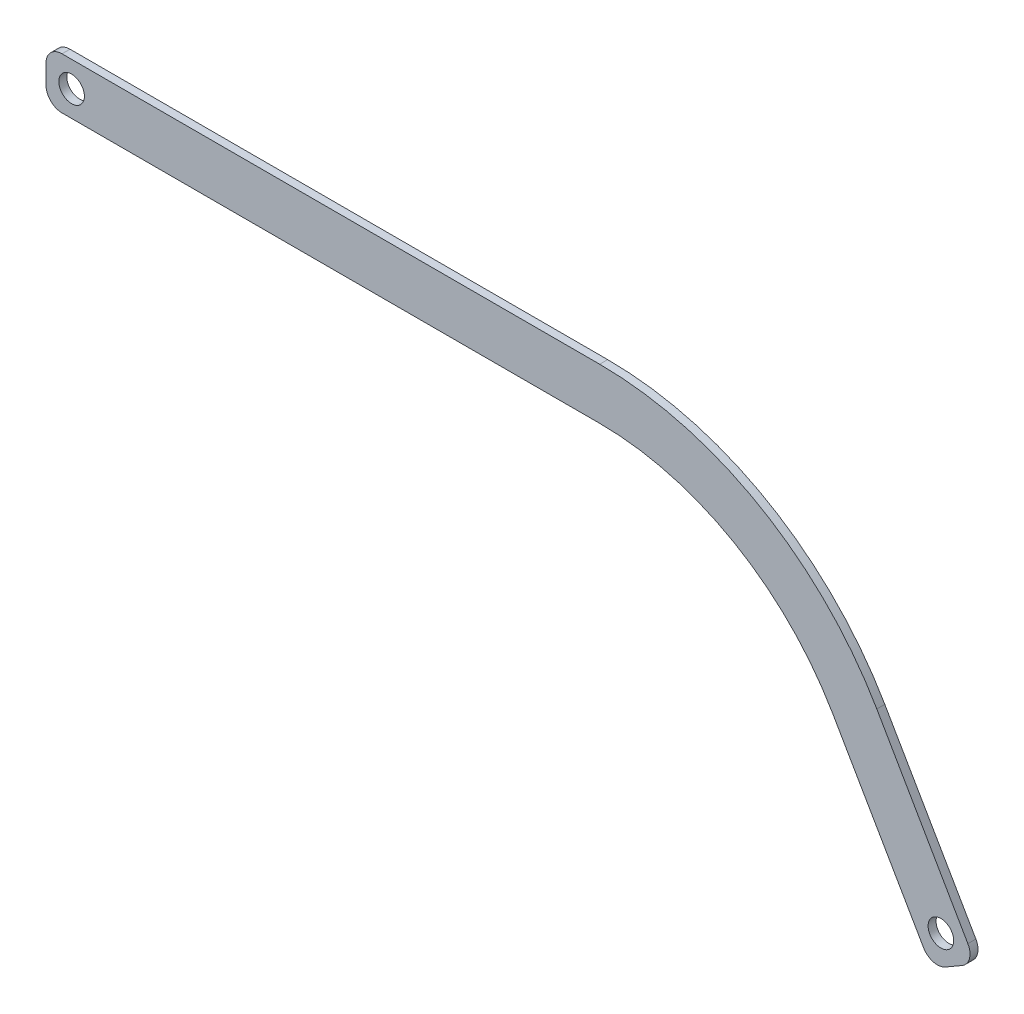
SolidWorks part; units mm, degrees
ref_plane "Plan de face" through (0, 0, 0) normal (0, 0, 1) x (1, 0, 0)
ref_plane "Plan de dessus" through (0, 0, 0) normal (0, 1, 0) x (1, 0, 0)
ref_plane "Plan de droite" through (0, 0, 0) normal (1, 0, 0) x (0, 0, -1)
sketch "Esquisse1" plane through (0, 0, 0) normal (0, 0, 1) x (1, 0, 0)
  line L0 (-6, 16) -> (330, 16)
  line L1 (-6, -16) -> (330, -16)
  line L2 (503.2051, -84) -> (560.1048, -182.5532)
  line L3 (556.4445, -196.2134) -> (546.0522, -202.2134)
  line L4 (475.4923, -100) -> (532.392, -198.5532)
  line L5 (-16, 6) -> (-16, -6)
  circle A0 centre (0, 0) radius 8
  arc A1 (560.1048, -182.5532) -> (556.4445, -196.2134) centre (551.4445, -187.5532) cw
  circle A2 centre (543.2484, -185.357) radius 8
  arc A3 (475.4923, -100) -> (330, -16) centre (330, -184) ccw
  arc A4 (503.2051, -84) -> (330, 16) centre (330, -184) ccw
  arc A5 (532.392, -198.5532) -> (546.0522, -202.2134) centre (541.0522, -193.5532) ccw
  arc A6 (-6, 16) -> (-16, 6) centre (-6, 6) ccw
  arc A7 (-6, -16) -> (-16, -6) centre (-6, -6) cw
  dimension "D3" = 330
  dimension "D4" = 16
  dimension "D8" = 10
  dimension "D5" = 574
  dimension "D6" = 16
  dimension "D10" = 10
  dimension "D11" = 16
  dimension "D9" = 200
  dimension "D13" = 168
  dimension "D15" = 16
  dimension "D1" = 16
  dimension "D2" = 16
  dimension "D7" = 60
  dimension "D12" = 16
  dimension "D14" = 32
extrude "Extrusion1" add sketch "Esquisse1" against normal blind 5
